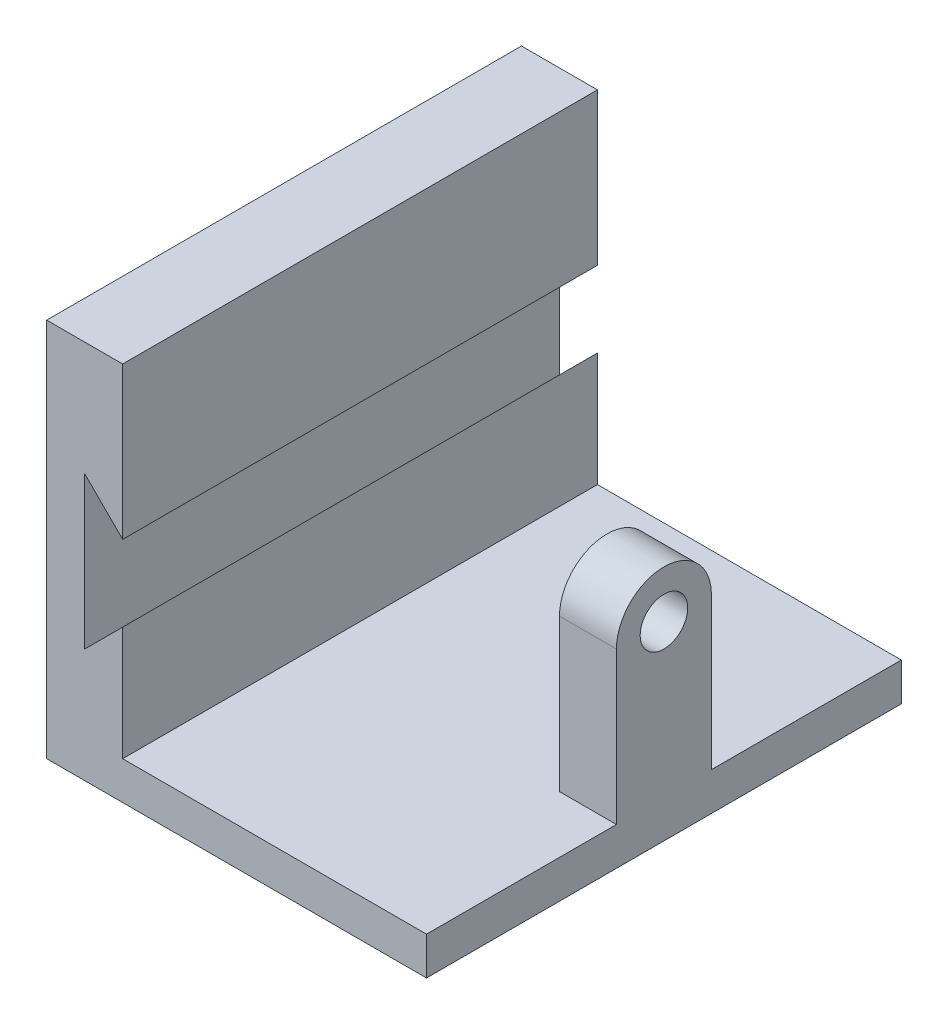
SolidWorks part; units mm, degrees
ref_plane "Front Plane" through (0, 0, 0) normal (0, 0, 1) x (1, 0, 0)
ref_plane "Top Plane" through (0, 0, 0) normal (0, 1, 0) x (1, 0, 0)
ref_plane "Right Plane" through (0, 0, 0) normal (1, 0, 0) x (0, 0, -1)
sketch "Sketch1" plane through (0, 0, 0) normal (0, 0, 1) x (1, 0, 0)
  line L0 (0, 0) -> (-200, 0)
  line L1 (-200, 0) -> (-200, 200)
  line L2 (-200, 200) -> (-160, 200)
  line L3 (-160, 200) -> (-160, 120)
  line L4 (-160, 20) -> (0, 20)
  line L5 (0, 20) -> (0, 0)
  line L6 (-160, 80) -> (-180, 60)
  line L7 (-180, 60) -> (-180, 140)
  line L8 (-180, 140) -> (-160, 120)
  line L9 (-160, 80) -> (-160, 20)
  line L10 (-160, 120) -> (-160, 80) construction
  point P10 (-180, 100)
  point P12 (-160, 100)
  dimension "D1" = 200
  dimension "D2" = 200
  dimension "D3" = 20
  dimension "D4" = 40
  dimension "D5" = 80
  dimension "D6" = 20
  dimension "D7" = 20
  dimension "D8" = 45
extrude "Boss-Extrude1" add sketch "Sketch1" along normal mid plane 250
sketch "Sketch2" plane through (0, 0, 0) normal (1, 0, 0) x (0, 0, -1)
  line L0 (0, 100) -> (0, 0) construction
  line L1 (-25, 100) -> (-25, 0)
  line L2 (-125, 0) -> (125, 0) construction
  line L3 (-25, 0) -> (0, 0)
  line L4 (0, 0) -> (25, 0)
  line L5 (25, 0) -> (25, 100)
  circle A0 centre (0, 100) radius 12.5
  arc A1 (25, 100) -> (-25, 100) centre (0, 100) ccw
  dimension "D1" = 25
  dimension "D2" = 25
  dimension "D3" = 100
extrude "Boss-Extrude2" add sketch "Sketch2" against normal blind 30
